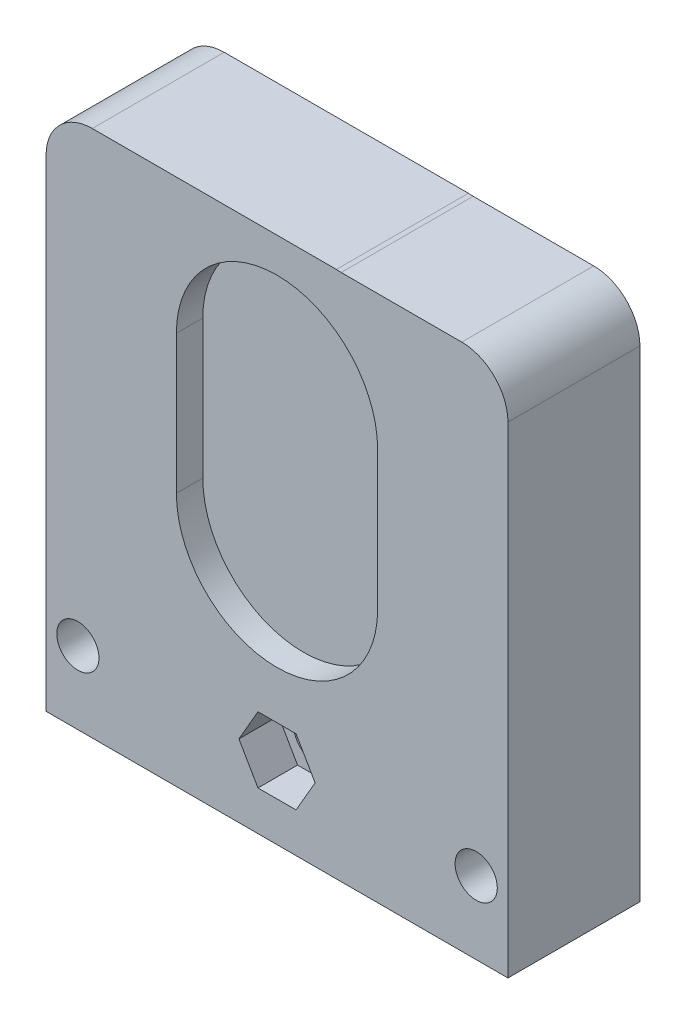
SolidWorks part; units mm, degrees
ref_plane "Front Plane" through (0, 0, 0) normal (0, 0, 1) x (1, 0, 0)
ref_plane "Top Plane" through (0, 0, 0) normal (0, 1, 0) x (1, 0, 0)
ref_plane "Right Plane" through (0, 0, 0) normal (1, 0, 0) x (0, 0, -1)
sketch "Sketch1" plane through (0, 0, 0) normal (0, 0, 1) x (1, 0, 0)
  line L0 (26, 80) -> (44, 80) construction
  line L1 (26, 80) -> (44, 80)
  line L2 (0, 18) -> (0, 0)
  line L3 (0, 0) -> (70, 0)
  line L4 (70, 18) -> (70, 0)
  line L5 (0, 0) -> (0, 18) construction
  line L6 (70, 0) -> (70, 18) construction
  line L7 (35, 80) -> (35, 0) construction
  line L8 (44, 80) -> (44.7245, 79.9604)
  line L9 (0, 18) -> (0, 80)
  line L10 (0, 80) -> (26, 80)
  line L11 (70, 18) -> (70, 79.9604)
  line L12 (70, 79.9604) -> (44.7245, 79.9604)
  point P8 (35, 80)
  dimension "D1" = 70
  dimension "D2" = 80
  dimension "D3" = 18
  dimension "D4" = 18
extrude "Boss-Extrude1" add sketch "Sketch1" along normal blind 20
fillet "Fillet1" radius 7 1 edges at (0, 80, 10)
sketch "Sketch2" plane through (0, 0, 20) normal (0, 0, 1) x (1, 0, 0)
  line L0 (0, 0) -> (70, 0) construction
  line L4 (0, 73) -> (0, 0) construction
  line L9 (4.815, 11) -> (65.185, 11) construction
  circle A0 centre (4.815, 11) radius 3.2
  circle A1 centre (65.185, 11) radius 3.2
  circle A2 centre (35, 11) radius 3.5
  dimension "D8" = 6.4
  dimension "D9" = 6.4
  dimension "D3" = 7
  dimension "D1" = 60.37
  dimension "D2" = 4.815
  dimension "D4" = 11
  dimension "D5" = 11
extrude "Cut-Extrude1" cut sketch "Sketch2" against normal through all
sketch "Sketch3" plane through (0, 0, 20) normal (0, 0, 1) x (1, 0, 0)
  line L0 (44, 80) -> (7, 80) construction
  line L1 (0, 73) -> (0, 0) construction
  line L2 (70, 0) -> (70, 79.9604) construction
  line L3 (19.75, 59.5) -> (19.75, 38.5)
  line L4 (50.25, 59.5) -> (50.25, 38.5)
  arc A0 (50.25, 59.5) -> (19.75, 59.5) centre (35, 59.5) ccw
  arc A1 (19.75, 38.5) -> (50.25, 38.5) centre (35, 38.5) ccw
  dimension "D1" = 30.5
  dimension "D2" = 20.5
  dimension "D3" = 35
  dimension "D4" = 35
  dimension "D5" = 21
  dimension "D6" = 21
extrude "Cut-Extrude2" cut sketch "Sketch3" against normal blind 4
sketch "Sketch7" plane through (0, 0, 20) normal (0, 0, 1) x (1, 0, 0)
  line L0 (0, 0) -> (70, 0) construction
  line L1 (40.7735, 11) -> (37.8868, 16)
  line L2 (37.8868, 16) -> (32.1132, 16)
  line L3 (32.1132, 16) -> (29.2265, 11)
  line L4 (29.2265, 11) -> (32.1132, 6)
  line L5 (32.1132, 6) -> (37.8868, 6)
  line L6 (37.8868, 6) -> (40.7735, 11)
  circle A0 centre (35, 11) radius 5 construction
  dimension "D1" = 10
  dimension "D2" = 11
extrude "Cut-Extrude3" cut sketch "Sketch7" against normal blind 6
sketch "Sketch8" plane through (0, 0, 20) normal (0, 0, 1) x (1, 0, 0)
  line L0 (13.9108, 80) -> (53.9108, 80) construction
  line L1 (44, 80) -> (7, 80) construction
  point P5 (33.9108, 80)
  dimension "D1" = 40
fillet "Fillet2" radius 7 1 edges at (70, 79.9604, 10)
